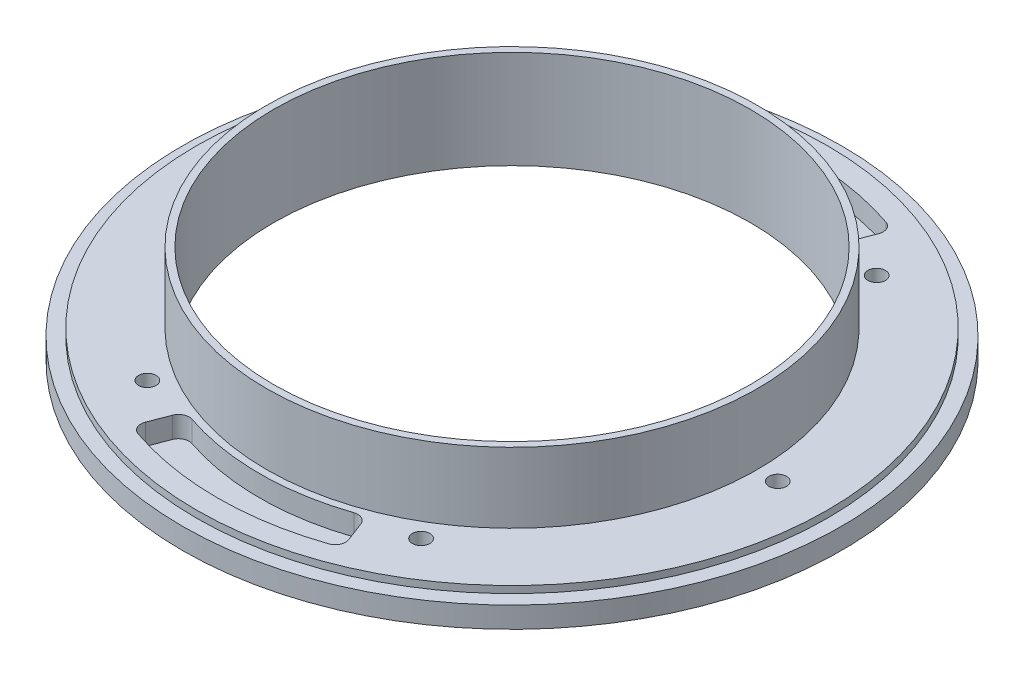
SolidWorks part; units mm, degrees
ref_plane "前视基准面" through (0, 0, 0) normal (0, 0, 1) x (1, 0, 0)
ref_plane "上视基准面" through (0, 0, 0) normal (0, 1, 0) x (1, 0, 0)
ref_plane "右视基准面" through (0, 0, 0) normal (1, 0, 0) x (0, 0, -1)
sketch "草图1" plane through (0, 0, 0) normal (0, 1, 0) x (1, 0, 0)
  circle A0 centre (0, 0) radius 47
  dimension "D1" = 94
extrude "凸台-拉伸1" add sketch "草图1" along normal blind 3
sketch "草图2" plane through (0, 3, 0) normal (0, 1, 0) x (1, 0, 0)
  circle A0 centre (0, 0) radius 45
  dimension "D1" = 90
extrude "凸台-拉伸2" add sketch "草图2" along normal blind 1
sketch "草图3" plane through (0, 4, 0) normal (0, 1, 0) x (1, 0, 0)
  circle A0 centre (0, 0) radius 35
  circle A1 centre (0, 0) radius 34
  dimension "D1" = 1
  dimension "D2" = 68
extrude "凸台-拉伸3" add sketch "草图3" along normal blind 10
sketch "草图4" plane through (0, 4, 0) normal (0, 1, 0) x (1, 0, 0)
  circle A1 centre (0, 0) radius 34
  circle A2 centre (0, 0) radius 34
  dimension "D1" = 0
extrude "切除-拉伸1" cut sketch "草图4" against normal through all
sketch "草图6" plane through (0, 27.5, 0) normal (0, 1, 0) x (1, 0, 0)
  circle A0 centre (-19.5199, 32.4866) radius 1.25
  circle A1 centre (19.5199, 32.4866) radius 1.25
  circle A2 centre (-37.9, 0) radius 1.25
  circle A3 centre (37.9, 0) radius 1.25
  circle A4 centre (-19.5199, -32.4866) radius 1.25
  circle A5 centre (19.5199, -32.4866) radius 1.25
extrude "切除-拉伸2" cut sketch "草图6" against normal through all
sketch "草图7" plane through (0, 0, 0) normal (0, -1, 0) x (1, 0, 0)
  circle A0 centre (-19.5199, 32.4866) radius 2.25
  circle A1 centre (-37.9, 0) radius 2.25
  circle A2 centre (19.5199, 32.4866) radius 2.25
  circle A3 centre (37.9, 0) radius 2.25
  circle A4 centre (19.5199, -32.4866) radius 2.25
  circle A5 centre (-19.5199, -32.4866) radius 2.25
  dimension "D1" = 4.5
extrude "切除-拉伸3" cut sketch "草图7" against normal blind 2
sketch "草图8" plane through (0, 4, 0) normal (0, 1, 0) x (1, 0, 0)
  line L0 (0, 0) -> (-15.0515, 39.2104)
  line L5 (0, 0) -> (0, 58.0505) construction
  line L6 (0, 0) -> (15.0515, 39.2104)
  line L7 (0, 0) -> (-63.1565, 0) construction
  line L8 (0, 0) -> (15.0515, -39.2104)
  line L9 (0, 0) -> (-15.0515, -39.2104)
  circle A0 centre (0, 0) radius 36
  circle A1 centre (0, 0) radius 42
  circle A2 centre (0, 0) radius 45 construction
  circle A3 centre (0, 0) radius 35 construction
  dimension "D1" = 3
  dimension "D2" = 1
  dimension "D3" = 21
extrude "切除-拉伸4" cut sketch "草图8" against normal blind 3 contours L6 A1 L0 A0 | L9 A1 L8 A0
fillet "圆角1" radius 1.5 8 edges at (-15.0515, 2.5, 39.2104) (15.0515, 2.5, 39.2104) (12.9012, 2.5, 33.6089) (-12.9012, 2.5, 33.6089) (15.0515, 2.5, -39.2104) (-12.9012, 2.5, -33.6089) (12.9012, 2.5, -33.6089) (-15.0515, 2.5, -39.2104)
